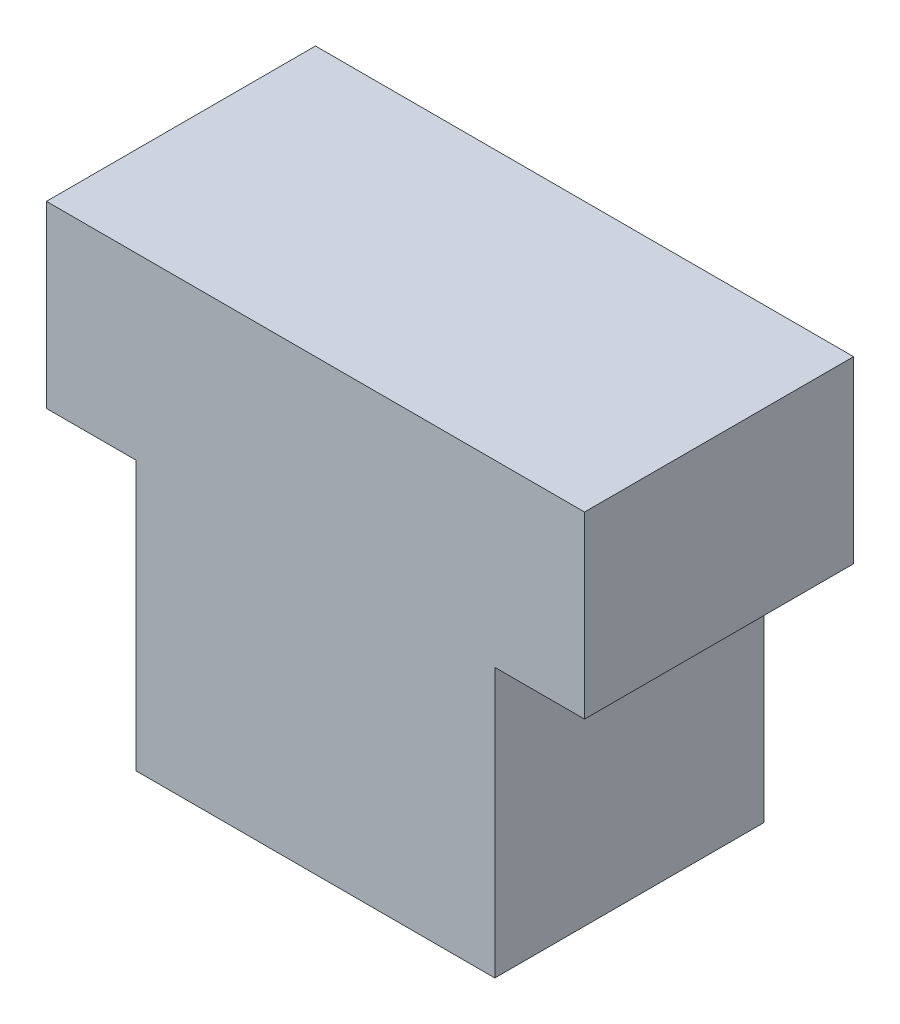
SolidWorks part; units mm, degrees
ref_plane "Front Plane" through (0, 0, 0) normal (0, 0, 1) x (1, 0, 0)
ref_plane "Top Plane" through (0, 0, 0) normal (0, 1, 0) x (1, 0, 0)
ref_plane "Right Plane" through (0, 0, 0) normal (1, 0, 0) x (0, 0, -1)
sketch "Sketch1" plane through (0, 0, 0) normal (0, 0, 1) x (1, 0, 0)
  line L0 (0, 0) -> (0, 15)
  line L1 (0, 15) -> (-5, 15)
  line L2 (-5, 15) -> (-5, 25)
  line L3 (-5, 25) -> (25, 25)
  line L4 (25, 25) -> (25, 15)
  line L5 (25, 15) -> (20, 15)
  line L6 (20, 15) -> (20, 0)
  line L7 (20, 0) -> (0, 0)
  dimension "D1" = 30
  dimension "D2" = 15
  dimension "D3" = 10
  dimension "D4" = 20
  dimension "D5" = 5
extrude "Boss-Extrude1" add sketch "Sketch1" along normal blind 15
